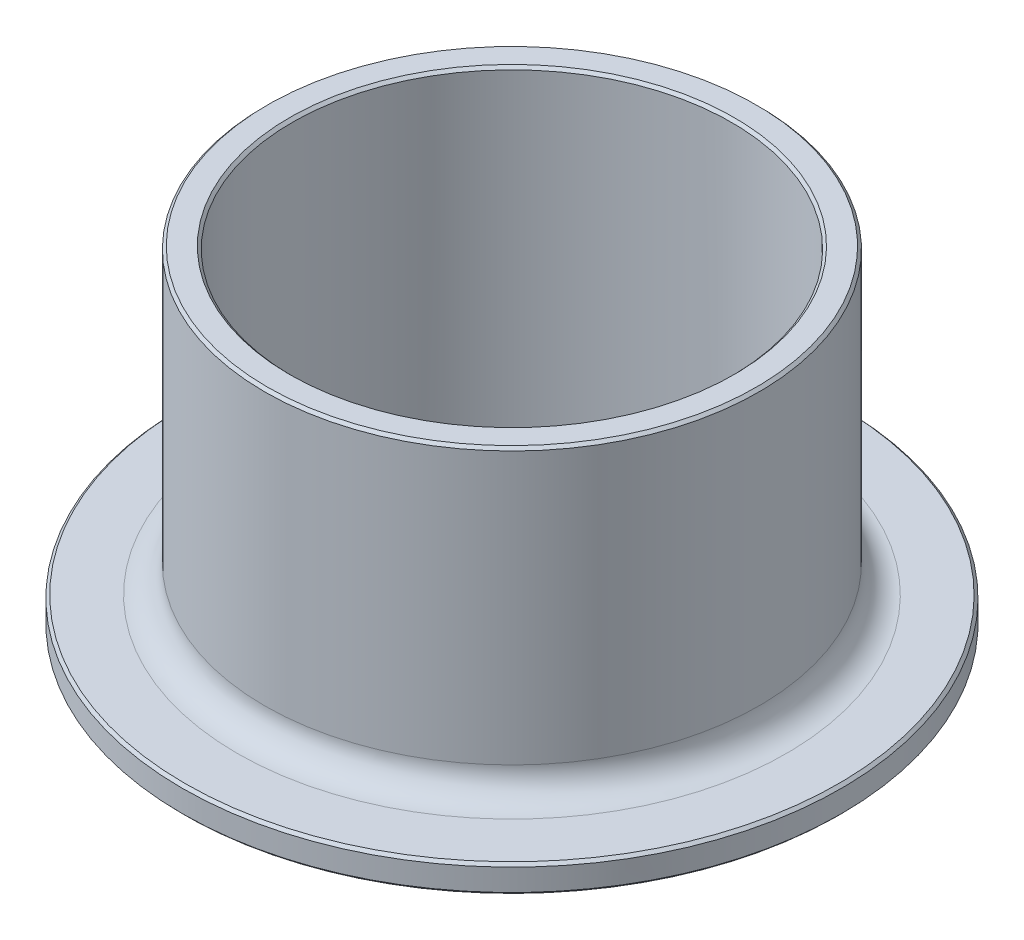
SolidWorks part; units mm, degrees
ref_plane "Plan de face" through (0, 0, 0) normal (0, 0, 1) x (1, 0, 0)
ref_plane "Plan de dessus" through (0, 0, 0) normal (0, 1, 0) x (1, 0, 0)
ref_plane "Plan de droite" through (0, 0, 0) normal (1, 0, 0) x (0, 0, -1)
sketch "Esquisse1" plane through (0, 0, 0) normal (0, 0, 1) x (1, 0, 0)
  line L0 (0, 29.2448) -> (0, -30.8321) construction
  line L1 (-8, 14.1628) -> (-9, 14.1628)
  line L2 (-9, 14.1628) -> (-9, 3.1628)
  line L3 (-9, 3.1628) -> (-12, 3.1628)
  line L4 (-12, 3.1628) -> (-12, 2.1628)
  line L5 (-12, 2.1628) -> (-8, 2.1628)
  line L6 (-8, 14.1628) -> (-8, 2.1628)
  dimension "D1" = 8
  dimension "D2" = 1
  dimension "D3" = 11
  dimension "D4" = 3
  dimension "D5" = 1
  dimension "D6" = 4
revolve "Révolution1" add sketch "Esquisse1" angle 360 about L0
fillet "Congé1" radius 1 1 edges at (0, 3.1628, 9)
chamfer "Chanfrein1" distance 0.1 angle 45 5 edges at (0, 2.1628, 8) (0, 2.1628, 12) (0, 3.1628, 12) (0, 14.1628, 9) (0, 14.1628, 8)
